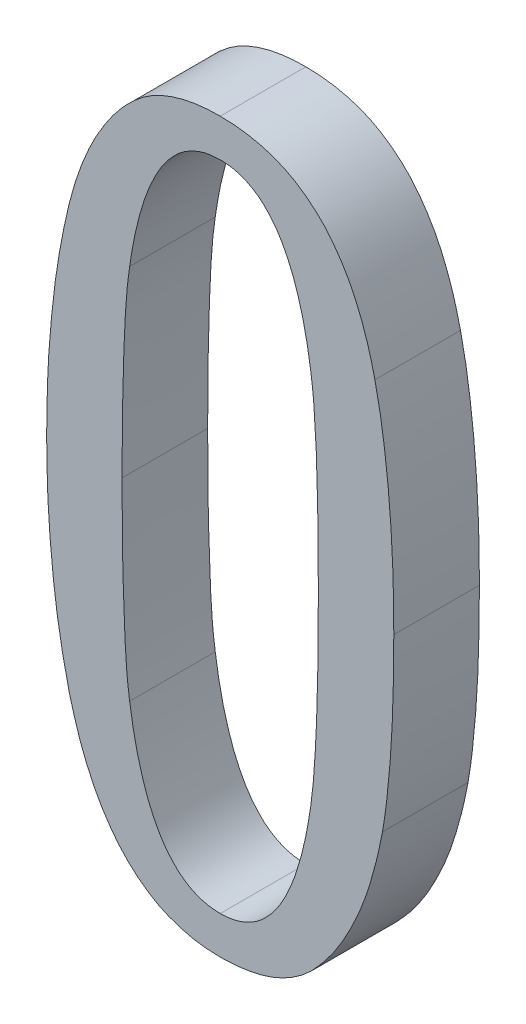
SolidWorks part; units mm, degrees
ref_plane "前基準面" through (0, 0, 0) normal (0, 0, 1) x (1, 0, 0)
ref_plane "上基準面" through (0, 0, 0) normal (0, 1, 0) x (1, 0, 0)
ref_plane "右基準面" through (0, 0, 0) normal (1, 0, 0) x (0, 0, -1)
sketch "草圖1" plane through (0, 0, 0) normal (0, 0, 1) x (1, 0, 0)
  text T0 "0" font "標楷體" height 25
extrude "填料-伸長1" add sketch "草圖1" along normal blind 3
